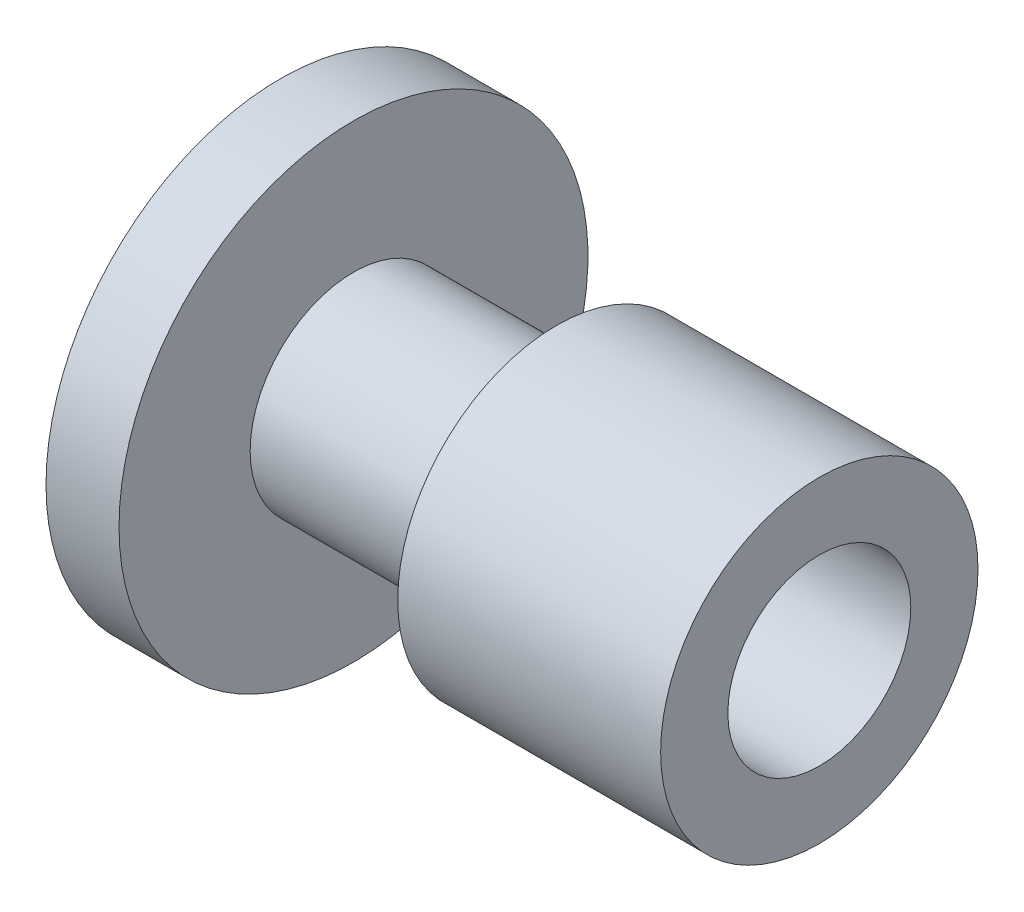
SolidWorks part; units mm, degrees
ref_plane "Front Plane" through (0, 0, 0) normal (0, 0, 1) x (1, 0, 0)
ref_plane "Top Plane" through (0, 0, 0) normal (0, 1, 0) x (1, 0, 0)
ref_plane "Right Plane" through (0, 0, 0) normal (1, 0, 0) x (0, 0, -1)
sketch "Sketch1" plane through (0, 0, 0) normal (0, 0, 1) x (1, 0, 0)
  line L0 (0, 0) -> (0, 30.353)
  line L1 (0, 30.353) -> (9.4534, 30.353)
  line L2 (9.4534, 30.353) -> (9.4534, 13.3786)
  line L3 (69.7561, 11.8417) -> (46.1236, 11.8417)
  line L4 (46.1236, 11.8417) -> (46.1236, 5.7323)
  line L5 (46.1236, 5.7323) -> (7.5475, 5.7323)
  line L7 (9.4534, 13.3786) -> (35.721, 13.3786)
  line L8 (35.721, 13.3786) -> (35.721, 20.5407)
  line L9 (35.721, 20.5407) -> (69.7561, 20.5407)
  line L10 (69.7561, 20.5407) -> (69.7561, 11.8417)
  line L12 (0, 0) -> (65.4851, 0) construction
  line L13 (7.5475, 5.7323) -> (7.5475, 0)
  line L14 (7.5475, 0) -> (0, 0)
revolve "Revolve1" add sketch "Sketch1" angle 360 about L12
ref_plane "Plane1" through (0, 0, 0) normal (0, -1, 0) x (1, 0, 0)
